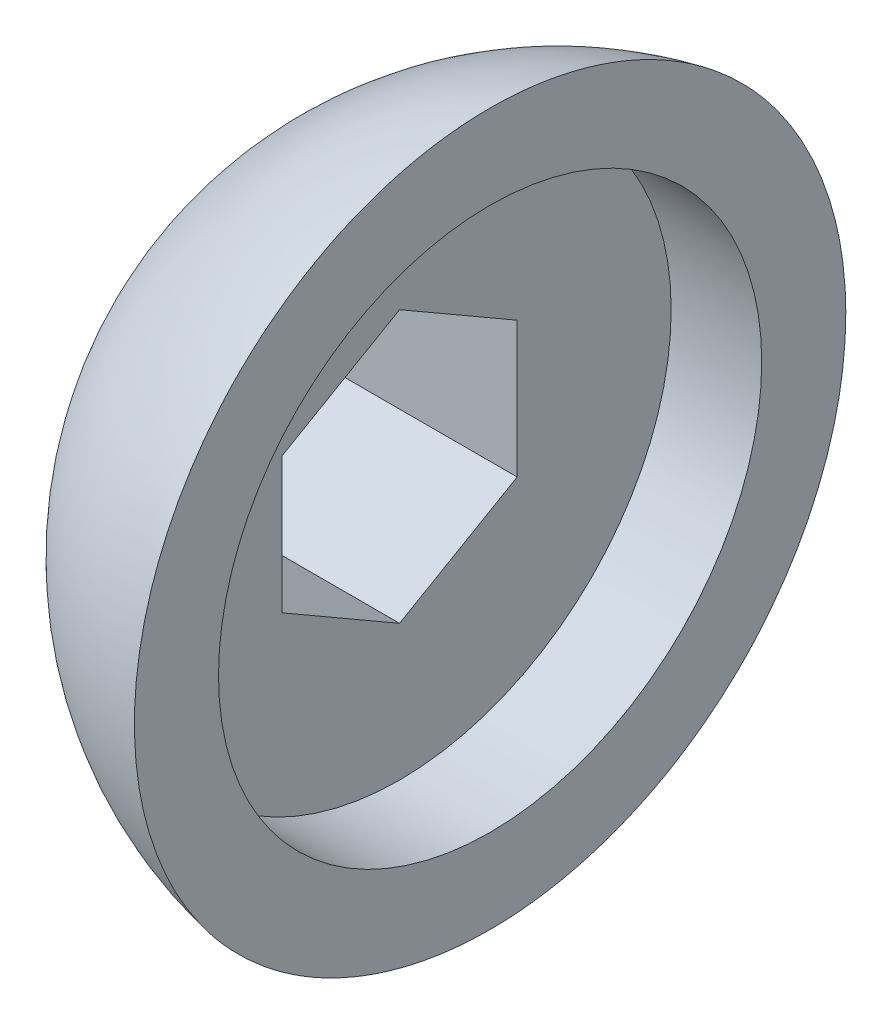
SolidWorks part; units mm, degrees
ref_plane "Plane1" through (0, 0, 0) normal (0, 0, 1) x (1, 0, 0)
ref_plane "Plane2" through (0, 0, 0) normal (0, 1, 0) x (1, 0, 0)
ref_plane "Plane3" through (0, 0, 0) normal (1, 0, 0) x (0, 0, -1)
imported_body "Imported1"
sketch "Sketch2" plane through (1.9261, 0, 0) normal (1, 0, 0) x (0, 0, -1)
  circle A0 centre (0, 0) radius 3.81
  dimension "D1" = 7.62
extrude "Cut-Extrude1" cut sketch "Sketch2" against normal blind 1.27
